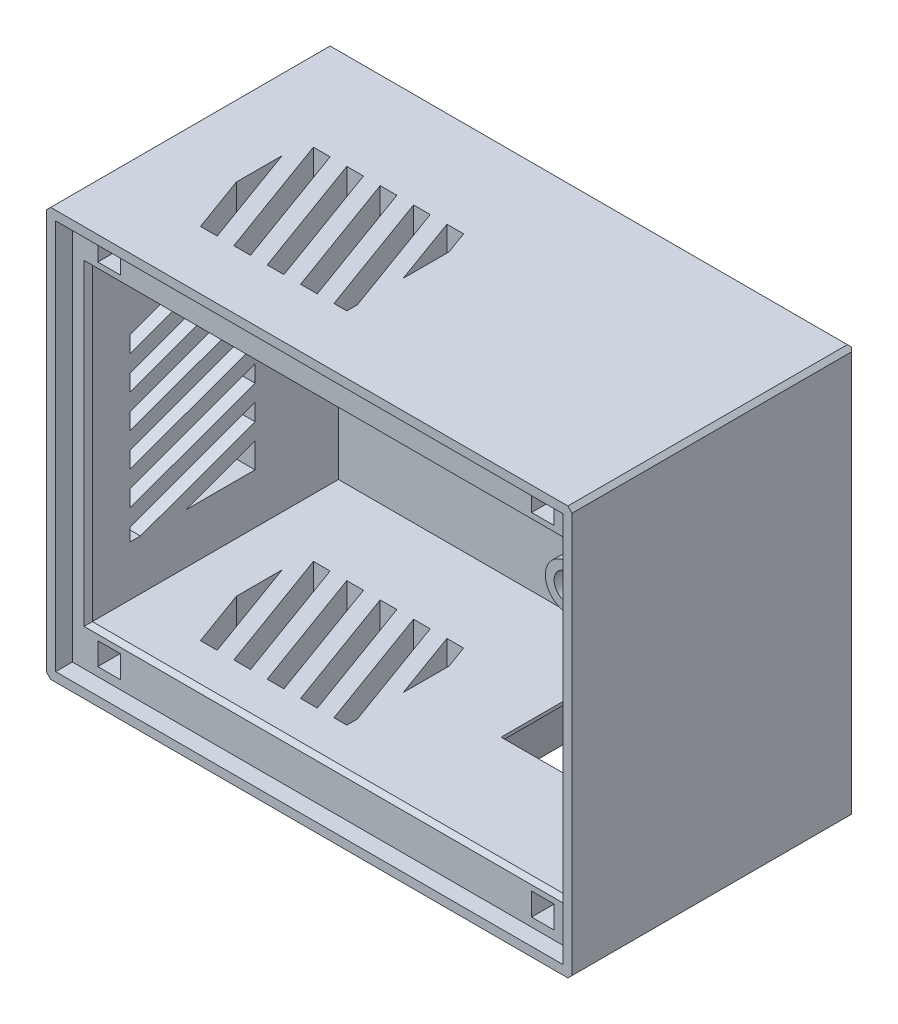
SolidWorks part; units mm, degrees
ref_plane "Спереди" through (0, 0, 0) normal (0, 0, 1) x (1, 0, 0)
ref_plane "Сверху" through (0, 0, 0) normal (0, 1, 0) x (1, 0, 0)
ref_plane "Справа" through (0, 0, 0) normal (1, 0, 0) x (0, 0, -1)
sketch "Эскиз1" plane through (0, 0, 0) normal (0, 0, 1) x (1, 0, 0)
  line L0 (0, 0) -> (0, 49)
  line L1 (0, 49) -> (-63, 49)
  line L2 (-63, 49) -> (-63, 0)
  line L3 (-63, 0) -> (0, 0)
extrude "Бобышка-Вытянуть1" add sketch "Эскиз1" along normal blind 35
sketch "Эскиз2" plane through (0, 0, 35) normal (0, 0, 1) x (1, 0, 0)
  line L0 (-63, 49) -> (-60, 49) construction
  line L1 (-60, 49) -> (-60, 43) construction
  line L2 (-63, 24.5) -> (0, 24.5) construction
  line L3 (-63, 49) -> (-63, 0) construction
  line L4 (0, 0) -> (0, 49) construction
  line L5 (-31.5, 49) -> (-31.5, 0) construction
  line L6 (0, 49) -> (-63, 49) construction
  line L7 (-63, 0) -> (0, 0) construction
  line L8 (-3, 49) -> (-3, 43) construction
  line L9 (0, 49) -> (-3, 49) construction
  line L10 (0, 0) -> (-3, 0) construction
  line L11 (-3, 0) -> (-3, 6) construction
  line L12 (-60, 0) -> (-60, 6) construction
  line L13 (-63, 0) -> (-60, 0) construction
  line L14 (-60, 43) -> (-60, 6)
  line L15 (-60, 6) -> (-3, 6)
  line L16 (-3, 6) -> (-3, 43)
  line L17 (-3, 43) -> (-60, 43)
extrude "Вырез-Вытянуть1" cut sketch "Эскиз2" against normal blind 32
sketch "Эскиз3" plane through (0, 0, 35) normal (0, 0, 1) x (1, 0, 0)
  line L0 (-63, 49) -> (-61.9, 49) construction
  line L1 (-61.9, 49) -> (-61.9, 47.9) construction
  line L2 (-31.5, 49) -> (-31.5, 0) construction
  line L3 (0, 49) -> (-63, 49) construction
  line L4 (-63, 0) -> (0, 0) construction
  line L5 (-31.5, 0) -> (-63, 24.5) construction
  line L6 (-63, 49) -> (-63, 0) construction
  line L7 (-63, 24.5) -> (0, 24.5) construction
  line L8 (0, 0) -> (0, 49) construction
  line L9 (-61.9, 0) -> (-61.9, 1.1) construction
  line L10 (-63, 0) -> (-61.9, 0) construction
  line L11 (0, 0) -> (-1.1, 0) construction
  line L12 (-1.1, 0) -> (-1.1, 1.1) construction
  line L13 (-1.1, 49) -> (-1.1, 47.9) construction
  line L14 (0, 49) -> (-1.1, 49) construction
  line L15 (-61.9, 47.9) -> (-1.1, 47.9)
  line L16 (-1.1, 47.9) -> (-1.1, 1.1)
  line L17 (-1.1, 1.1) -> (-61.9, 1.1)
  line L18 (-61.9, 1.1) -> (-61.9, 47.9)
extrude "Вырез-Вытянуть2" cut sketch "Эскиз3" against normal blind 2
sketch "Эскиз4" plane through (0, 0, 33) normal (0, 0, 1) x (1, 0, 0)
  line L0 (-63, 24.5) -> (0, 24.5) construction
  line L1 (-63, 45.5) -> (-57.5, 45.5) construction
  line L2 (-63, 49) -> (-63, 0) construction
  line L3 (0, 0) -> (0, 49) construction
  line L4 (0, 24.5) -> (-31.5, 49) construction
  line L5 (0, 49) -> (-63, 49) construction
  line L6 (-31.5, 49) -> (-31.5, 0) construction
  line L7 (-63, 0) -> (0, 0) construction
  line L8 (-6.85, 44.15) -> (-4.15, 44.15)
  line L9 (-56.15, 46.85) -> (-58.85, 46.85)
  line L10 (-56.15, 46.85) -> (-56.15, 44.15)
  line L11 (-56.15, 44.15) -> (-58.85, 44.15)
  line L12 (-58.85, 46.85) -> (-58.85, 44.15)
  line L13 (-56.15, 46.85) -> (-58.85, 44.15) construction
  line L14 (-56.15, 44.15) -> (-58.85, 46.85) construction
  line L15 (-4.15, 46.85) -> (-4.15, 44.15)
  line L16 (-6.85, 46.85) -> (-4.15, 46.85)
  line L17 (-6.85, 46.85) -> (-6.85, 44.15)
  line L18 (-56.15, 4.85) -> (-58.85, 4.85)
  line L19 (-58.85, 2.15) -> (-58.85, 4.85)
  line L20 (-56.15, 2.15) -> (-58.85, 2.15)
  line L21 (-56.15, 2.15) -> (-56.15, 4.85)
  line L22 (-6.85, 2.15) -> (-6.85, 4.85)
  line L23 (-6.85, 2.15) -> (-4.15, 2.15)
  line L24 (-4.15, 2.15) -> (-4.15, 4.85)
  line L25 (-6.85, 4.85) -> (-4.15, 4.85)
extrude "Вырез-Вытянуть4" cut sketch "Эскиз4" against normal blind 10
sketch "Эскиз5" plane through (0, 0, 0) normal (0, -1, 0) x (-1, 0, 0)
  line L0 (0, 0) -> (0, -11) construction
  line L1 (0, -11) -> (12.5, -11) construction
  line L2 (12.5, -11) -> (23.5, -11)
  line L3 (23.5, -11) -> (23.5, -20)
  line L4 (23.5, -20) -> (12.5, -20)
  line L5 (12.5, -20) -> (12.5, -11)
extrude "Вырез-Вытянуть6" cut sketch "Эскиз5" against normal blind 13
sketch "Эскиз6" plane through (0, 0, 0) normal (0, -1, 0) x (-1, 0, 0)
  line L0 (63, 0) -> (54, 0) construction
  line L1 (54, 0) -> (54, -13) construction
  line L2 (54, -13) -> (39, -13)
  line L3 (39, -13) -> (39, -28)
  line L6 (55, -13) -> (53, -13)
  line L7 (55, -13) -> (48.0034, -32.223)
  line L8 (48.0034, -32.223) -> (46.0034, -32.223)
  line L9 (53, -13) -> (46.0034, -32.223)
  line L10 (49, -13) -> (42.0034, -32.223)
  line L11 (44.0034, -32.223) -> (42.0034, -32.223)
  line L12 (51, -13) -> (44.0034, -32.223)
  line L13 (51, -13) -> (49, -13)
  line L14 (45, -13) -> (38.0034, -32.223)
  line L15 (40.0034, -32.223) -> (38.0034, -32.223)
  line L16 (47, -13) -> (40.0034, -32.223)
  line L17 (47, -13) -> (45, -13)
  line L18 (41, -13) -> (34.0034, -32.223)
  line L19 (36.0034, -32.223) -> (34.0034, -32.223)
  line L20 (43, -13) -> (36.0034, -32.223)
  line L21 (43, -13) -> (41, -13)
  line L22 (57, -13) -> (50.0034, -32.223)
  line L23 (52.0034, -32.223) -> (50.0034, -32.223)
  line L24 (59, -13) -> (52.0034, -32.223)
  line L25 (59, -13) -> (57, -13)
  line L26 (54, -13) -> (54, -26.7374)
  line L27 (39, -28) -> (53.5404, -28)
  dimension "D1" = 4
  dimension "D2" = 2
extrude "Вырез-Вытянуть7" cut sketch "Эскиз6" against normal blind 53 contours L7 L27 L22 L26 | L12 L27 L9 L2 | L16 L27 L10 L2 | L3 L27 L14 L2 L20 | L18 L2 L3
sketch "Эскиз7" plane through (-63, 0, 0) normal (-1, 0, 0) x (0, 0, 1)
  line L0 (0, 49) -> (0, 32) construction
  line L1 (0, 32) -> (13, 32) construction
  line L2 (13, 32) -> (13, 17)
  line L3 (13, 15) -> (32.223, 8.0034)
  line L24 (13, 33) -> (13, 31)
  line L25 (13, 33) -> (32.223, 26.0034)
  line L26 (13, 32) -> (13, 37) construction
  line L27 (13, 37) -> (28, 37) construction
  line L48 (28, 35.5404) -> (28, 31.5404) construction
  line L49 (32.223, 26.0034) -> (32.223, 24.0034)
  line L50 (13, 31) -> (32.223, 24.0034)
  line L51 (13, 27) -> (32.223, 20.0034)
  line L52 (32.223, 22.0034) -> (32.223, 20.0034)
  line L53 (13, 29) -> (32.223, 22.0034)
  line L54 (13, 29) -> (13, 27)
  line L55 (13, 23) -> (32.223, 16.0034)
  line L56 (32.223, 18.0034) -> (32.223, 16.0034)
  line L57 (13, 25) -> (32.223, 18.0034)
  line L58 (13, 25) -> (13, 23)
  line L59 (13, 19) -> (32.223, 12.0034)
  line L60 (32.223, 14.0034) -> (32.223, 12.0034)
  line L61 (13, 21) -> (32.223, 14.0034)
  line L62 (13, 21) -> (13, 19)
  line L63 (13, 35) -> (32.223, 28.0034)
  line L64 (32.223, 30.0034) -> (32.223, 28.0034)
  line L65 (13, 37) -> (32.223, 30.0034)
  line L66 (13, 37) -> (13, 35)
  line L67 (28, 31.5404) -> (28, 35.5404)
  line L68 (28, 17) -> (28, 31.5404)
  line L69 (23.9899, 37) -> (13, 37)
  line L70 (13, 35) -> (13, 33)
  line L71 (13, 17) -> (13, 12)
  line L72 (13, 12) -> (28, 12)
  line L73 (28, 12) -> (28, 17)
  line L74 (32.223, 10.0034) -> (32.223, 8.0034)
  line L75 (13, 17) -> (32.223, 10.0034)
  line L76 (13, 17) -> (13, 15)
  line L77 (13, 39) -> (32.223, 32.0034)
  line L78 (32.223, 34.0034) -> (32.223, 32.0034)
  line L79 (13, 41) -> (32.223, 34.0034)
  line L80 (13, 41) -> (13, 39)
  dimension "D1" = 2
  dimension "D2" = 2
extrude "Вырез-Вытянуть9" cut sketch "Эскиз7" against normal blind 13
sketch "Эскиз8" plane through (0, 0, 3) normal (0, 0, 1) x (1, 0, 0)
  line L0 (-63, 24.5) -> (0, 24.5) construction
  line L1 (-63, 49) -> (-63, 0) construction
  line L2 (0, 0) -> (0, 49) construction
  line L3 (-31.5, 24.5) -> (-31.5, 9.5) construction
  circle A0 centre (-31.5, 9.5) radius 1.65
  circle A1 centre (-31.5, 39.5) radius 1.65
extrude "Вырез-Вытянуть10" cut sketch "Эскиз8" against normal blind 13
sketch "Эскиз9" plane through (0, 0, 0) normal (0, 0, -1) x (-1, 0, 0)
  line L0 (0, 49) -> (0, 37.5) construction
  line L1 (0, 37.5) -> (11.4418, 49) construction
  line L2 (0, 49) -> (63, 49) construction
  line L3 (0, 37.5) -> (0, 11.5)
  line L4 (0, 0) -> (0, 49) construction
  line L5 (0, 11.5) -> (63, 11.5)
  line L6 (63, 49) -> (63, 0) construction
  line L7 (63, 11.5) -> (63, 37.5)
  line L8 (63, 37.5) -> (0, 37.5)
extrude "Вырез-Вытянуть11" cut sketch "Эскиз9" against normal blind 0.5
other "ДополнительноеОтверстие1" parameters "D1"=0
sketch "Эскиз10" plane through (0, 0, 0) normal (0, 0, -1) x (-1, 0, 0)
  point P0 (31.5, 39.5)
  point P3 (31.5, 9.5)
  point P6 (31.5, 9.5)
  point P8 (31.5, 9.5)
sketch "Эскиз11" plane through (-31.5, 39.5, 0) normal (0, -1, 0) x (1, 0, 0)
  line L0 (0, 0) -> (0, 1.66)
  line L1 (0, -0.83) -> (0, 2.49) construction
  line L2 (3.36, 0) -> (1.7, 1.66)
  line L3 (-3.36, 0) -> (-1.7, 1.66) construction
  line L4 (0, 0) -> (3.36, 0)
  line L5 (1.7, 1.66) -> (0, 1.66)
  dimension "D1" = 1.66
  dimension "D2" = 6.72
  dimension "D3" = 90
other "ДополнительноеОтверстие2" parameters "D1"=0
sketch "Эскиз12" plane through (0, 0, 0) normal (0, 0, -1) x (-1, 0, 0)
  point P0 (31.5, 9.5)
sketch "Эскиз13" plane through (-31.5, 9.5, 0) normal (0, -1, 0) x (1, 0, 0)
  line L0 (0, 0) -> (0, 1.66)
  line L1 (0, -0.83) -> (0, 2.49) construction
  line L2 (3.36, 0) -> (1.7, 1.66)
  line L3 (-3.36, 0) -> (-1.7, 1.66) construction
  line L4 (0, 0) -> (3.36, 0)
  line L5 (1.7, 1.66) -> (0, 1.66)
  dimension "D1" = 1.66
  dimension "D2" = 6.72
  dimension "D3" = 90
chamfer "Фаска2" distance 0.5 angle 45 8 edges at (-3, 24.5, 33) (-31.5, 6, 33) (-60, 24.5, 33) (-31.5, 43, 33) (0, 0, 17.5) (-63, 0, 17.5) (-63, 49, 17.5) (0, 49, 17.5)
chamfer "Фаска3" distance 1.5 angle 45 4 edges at (-31.5, 49, 0) (-63, 6, 0) (-31.5, 0, 0) (0, 6, 0)
chamfer "Фаска4" distance 1.5 angle 75 4 edges at (-12.5, 0, 15.5) (-18, 0, 20) (-23.5, 0, 15.5) (-18, 0, 11)
sketch "Эскиз14" plane through (0, 0, 3) normal (0, 0, 1) x (1, 0, 0)
  circle A0 centre (-31.5, 39.5) radius 2.7
  circle A1 centre (-31.5, 9.5) radius 2.7
  circle A2 centre (-31.5, 9.5) radius 1.65
  circle A3 centre (-31.5, 39.5) radius 1.65
extrude "Бобышка-Вытянуть7" add sketch "Эскиз14" along normal blind 1
sketch "Эскиз16" plane through (0, 49, 0) normal (0, 1, 0) x (1, 0, 0)
  line L0 (-39, -13) -> (-24, -13) construction
  line L1 (-39, -28) -> (-24, -28) construction
  line L2 (-24, -28) -> (-24, -13) construction
  line L3 (-39, -28) -> (-54, -28) construction
  line L4 (-54, -28) -> (-54, -13) construction
  line L5 (-54, -13) -> (-39, -13) construction
  line L6 (-39, -28) -> (-39, -13) construction
  line L7 (-41.5404, -28) -> (-43.5404, -28)
  line L8 (-43.5404, -28) -> (-49, -13)
  line L9 (-49, -13) -> (-47, -13)
  line L10 (-47, -13) -> (-41.5404, -28)
  line L11 (-37, -13) -> (-35, -13)
  line L12 (-34, -15.7475) -> (-34, -21.2424)
  line L13 (-43, -13) -> (-37.5404, -28)
  line L14 (-37.5404, -28) -> (-39.5404, -28)
  line L15 (-39.5404, -28) -> (-45, -13)
  line L16 (-45, -13) -> (-43, -13)
  line L17 (-39, -13) -> (-34, -26.7374)
  line L18 (-34, -28) -> (-35.5404, -28)
  line L19 (-35.5404, -28) -> (-41, -13)
  line L20 (-41, -13) -> (-39, -13)
  line L21 (-35, -13) -> (-34, -15.7475)
  line L23 (-34, -21.2424) -> (-37, -13)
  line L25 (-29.5404, -28) -> (-31.5404, -28)
  line L26 (-34, -26.7374) -> (-34, -28)
  line L27 (-37, -13) -> (-35, -13)
  dimension "D1" = 15
  dimension "D2" = 15
  dimension "D3" = 4
extrude "Вырез-Вытянуть12" cut sketch "Эскиз16" against normal through all both and the other way through all
